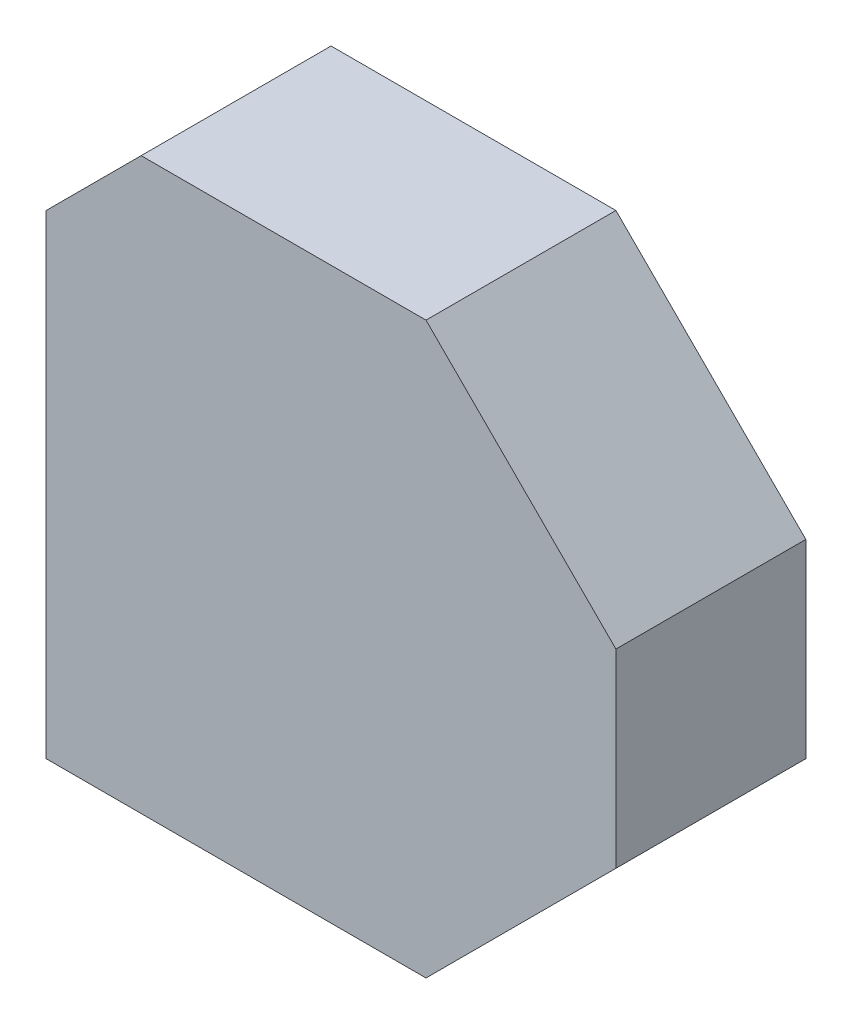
SolidWorks part; units mm, degrees
ref_plane "Plan de face" through (0, 0, 0) normal (0, 0, 1) x (1, 0, 0)
ref_plane "Plan de dessus" through (0, 0, 0) normal (0, 1, 0) x (1, 0, 0)
ref_plane "Plan de droite" through (0, 0, 0) normal (1, 0, 0) x (0, 0, -1)
sketch "Esquisse1" plane through (0, 0, 0) normal (0, 0, 1) x (1, 0, 0)
  line L1 (0, 0) -> (30, 0)
  line L2 (0, 0) -> (0, 30)
  line L3 (0, 30) -> (30, 30)
  line L4 (30, 0) -> (30, 30)
  dimension "D1" = 30
  dimension "D2" = 30
extrude "Boss.-Extru.1" add sketch "Esquisse1" along normal blind 10
chamfer "Chanfrein1" distance 10 angle 45 2 edges at (30, 0, 5) (30, 30, 5)
chamfer "Chanfrein2" distance 5 angle 45 1 edges at (0, 30, 5)
